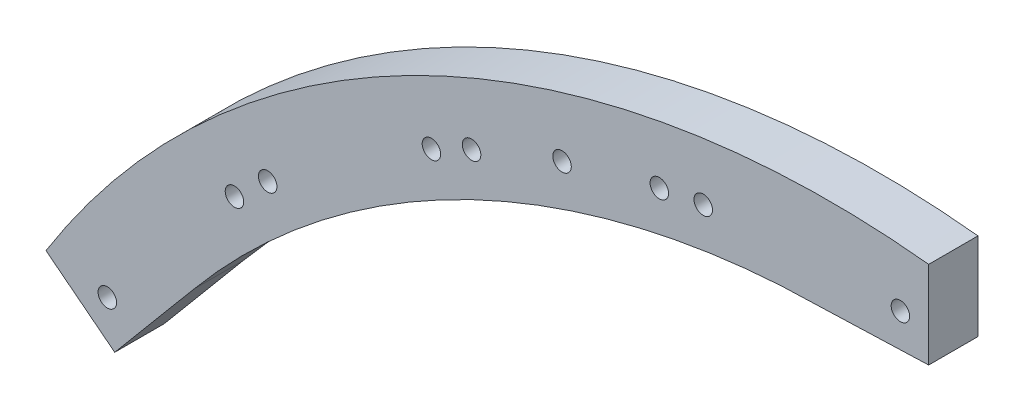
SolidWorks part; units mm, degrees
ref_plane "Front" through (0, 0, 0) normal (0, 0, 1) x (1, 0, 0)
ref_plane "Top" through (0, 0, 0) normal (0, 1, 0) x (1, 0, 0)
ref_plane "Right" through (0, 0, 0) normal (1, 0, 0) x (0, 0, -1)
sketch "Sketch1" plane through (0, 0, 0) normal (0, 0, 1) x (1, 0, 0)
  line L0 (-18.5645, 5.9536) -> (-1.0086, 5.9536) construction
  line L2 (0, 0) -> (0, 5.6149)
  line L3 (-56.8287, -22.034) -> (-52.4041, -25.4909)
  line L6 (-9.525, -0.3326) -> (0, 0)
  line L7 (-52.4041, -25.4909) -> (-47.2988, -19.4067)
  arc A2 (0, 5.6149) -> (-56.8287, -22.034) centre (-6.3414, -53.5776) ccw
  arc A4 (-9.525, -0.3326) -> (-47.2988, -19.4067) centre (-6.3414, -53.5776) ccw
  dimension "D1" = 53.3401
  dimension "D2" = 59.5312
  dimension "D3" = 6.1911
  dimension "D4" = 52
  dimension "D5" = 5.6149
  dimension "D6" = 5.6149
  dimension "D7" = 9.525
  dimension "D8" = 7.9375
  dimension "D9" = 92
  dimension "D10" = 92
extrude "Boss-Extrude1" add sketch "Sketch1" along normal blind 3.175
hole_wizard "#0-80 Tapped Hole1" positions "Sketch3" profile "Sketch2" tap size "#0-80" standard "Ansi Inch"
sketch "Sketch3" plane through (0, 0, 3.175) normal (0, 0, 1) x (1, 0, 0)
  line L0 (-6.3414, -53.5776) -> (-23.6047, -0.4464) construction
  line L2 (0, 0) -> (0, 5.6149) construction
  arc A1 (0.0005, 1.9267) -> (-53.8645, -24.2092) centre (-6.3414, -53.5776) ccw construction
  point P1 (-1.821, 2.1005)
  point P4 (-14.5142, 1.6846)
  point P7 (-17.3432, 1.192)
  point P10 (-29.43, -2.7065)
  point P13 (-32.0136, -3.9598)
  point P16 (-42.5576, -11.0389)
  point P19 (-44.6957, -12.9557)
  point P22 (-52.88, -22.6669)
  point P49 (-23.6047, -0.4464)
  dimension "D1" = 1.821
  dimension "D2" = 14.5142
  dimension "D3" = 17.3432
  dimension "D4" = 29.43
  dimension "D5" = 32.0136
  dimension "D6" = 42.5576
  dimension "D7" = 44.6957
  dimension "D8" = 52.88
  dimension "D9" = 1.192
  dimension "D10" = 1.6846
  dimension "D11" = 2.1005
  dimension "D12" = 2.7065
  dimension "D13" = 3.9598
  dimension "D14" = 11.0389
  dimension "D15" = 12.9557
  dimension "D16" = 22.6669
  dimension "D17" = 18
sketch "Sketch2" plane through (-1.821, 2.1005, 3.175) normal (1, 0, 0) x (0, -1, 0)
  line L0 (0, 0) -> (0, 3.175)
  line L1 (0, 3.175) -> (0.5956, 3.175)
  line L2 (0.5956, 3.175) -> (0.5956, 0)
  line L5 (0.5956, 0) -> (0, 0)
  line L11 (0, -6.35) -> (0, 107.95) construction
  dimension "Thru Tap Drill Dia." = 1.1913
  dimension "Thru Tap Drill Depth" = 3.175
